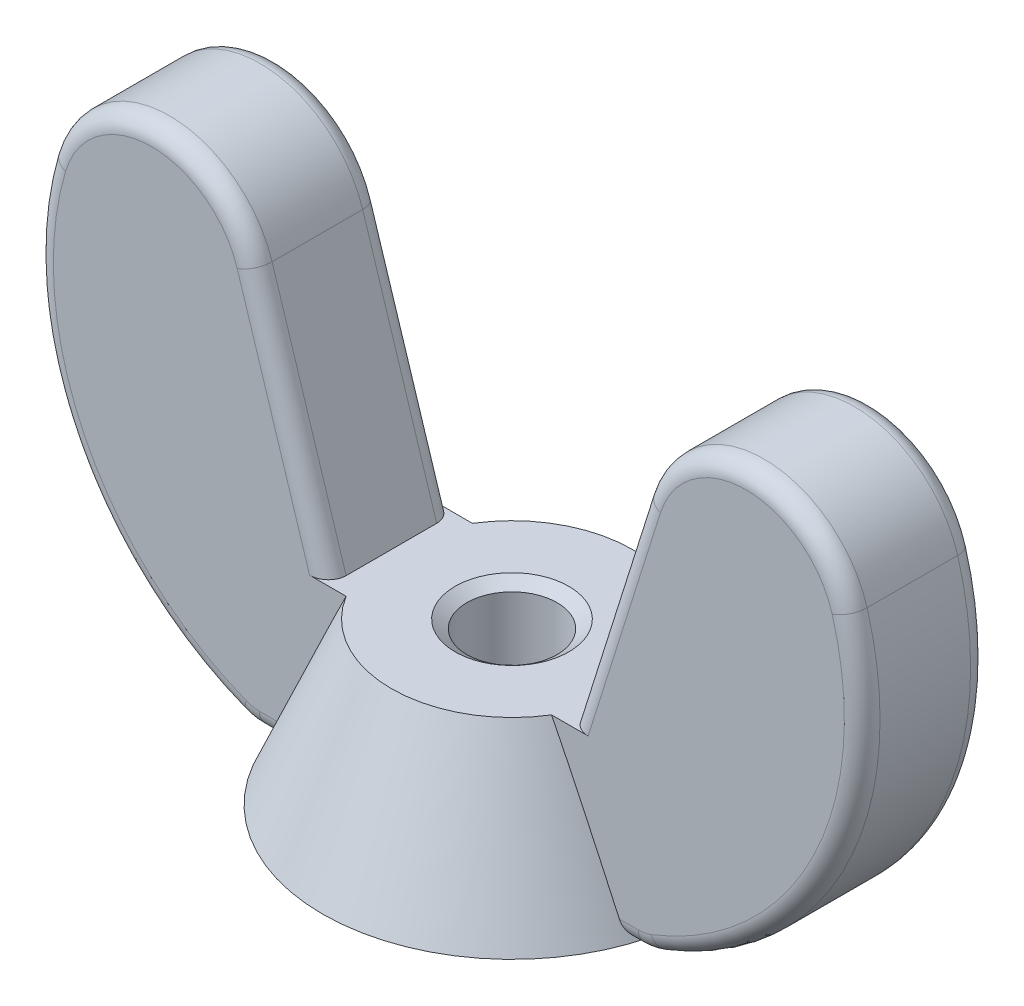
SolidWorks part; units mm, degrees
ref_plane "Front Plane" through (0, 0, 0) normal (0, 0, 1) x (1, 0, 0)
ref_plane "Top Plane" through (0, 0, 0) normal (0, 1, 0) x (1, 0, 0)
ref_plane "Right Plane" through (0, 0, 0) normal (1, 0, 0) x (0, 0, -1)
sketch "WingSke" plane through (0, 0, 0) normal (0, 0, 1) x (1, 0, 0)
  line L0 (-98.8178, 0) -> (98.8178, 0) construction
  line L1 (4.6101, 0) -> (-4.6101, 0) construction
  line L2 (0, 62.7504) -> (0, -62.7504) construction
  line L3 (-2.667, 3.556) -> (2.667, 3.556)
  line L4 (2.667, 3.556) -> (4.3047, 8.7501)
  line L7 (4.191, 0) -> (-4.191, 0)
  line L10 (-4.3047, 8.7501) -> (-2.667, 3.556)
  arc A0 (4.3047, 8.7501) -> (8.8574, 8.7032) centre (6.5739, 8.0346) cw
  arc A1 (8.8574, 8.7032) -> (4.6228, 0.0814) centre (2.032, 6.7048) cw
  arc A2 (4.6228, 0.0814) -> (4.191, 0) centre (4.191, 1.1853) cw
  arc A3 (-4.191, 0) -> (-4.6228, 0.0814) centre (-4.191, 1.1853) cw
  arc A4 (-4.6228, 0.0814) -> (-8.8574, 8.7032) centre (-2.032, 6.7048) cw
  arc A5 (-8.8574, 8.7032) -> (-4.3047, 8.7501) centre (-6.5739, 8.0346) cw
  circle A6 centre (0, 0) radius 4.191 construction
  point P29 (0, 0)
extrude "Wing" add sketch "WingSke" along normal mid plane 2.794
sketch "BossSke" plane through (0, 0, 0) normal (0, 0, 1) x (1, 0, 0)
  line L0 (-2.667, 3.556) -> (-4.191, 0)
  line L1 (2.667, 3.556) -> (-2.667, 3.556) construction
  line L2 (4.6101, 0) -> (-4.6101, 0) construction
  line L3 (-4.191, 0) -> (0, 0)
  line L4 (0, 0) -> (0, 3.556)
  line L5 (0, 3.556) -> (-2.667, 3.556)
revolve "Boss" add sketch "BossSke" angle 360 about L4
sketch "BossHoleSke" plane through (0, 0, 0) normal (0, 0, 1) x (1, 0, 0)
  line L0 (0, 3.556) -> (0, 0)
  line L1 (2.2718, 3.556) -> (-2.2718, 3.556) construction
  line L2 (0, 0) -> (0.9969, 0)
  line L3 (4.6101, 0) -> (-4.6101, 0) construction
  line L5 (0.9969, 0) -> (0.9969, 3.556)
  line L7 (0.9969, 3.556) -> (0, 3.556)
  line L8 (0, 3.556) -> (0, 7.112) construction
revolve "BossHole" cut sketch "BossHoleSke" angle 360 about L8
sketch "Sketch7" plane through (0, 0, 0) normal (0, 0, 1) x (1, 0, 0)
  line L0 (0.997, 3.3737) -> (1.2573, 3.556)
  line L1 (0.997, 0) -> (0.9969, 3.556) construction
  line L2 (2.2718, 3.556) -> (-2.2718, 3.556) construction
  line L5 (0.9969, 3.556) -> (0.997, 3.3737)
  line L6 (0.997, 0.1823) -> (0.997, 0)
  line L7 (0.997, 0) -> (1.2573, 0)
  line L8 (-3.9513, 0) -> (3.9513, 0) construction
  line L9 (1.2573, 0) -> (0.997, 0.1823)
  line L10 (0.9969, 3.556) -> (1.2573, 3.556)
revolve "Cut-Revolve2" cut sketch "Sketch7" angle 360 about L2
fillet "WingFillet" radius 0.3951 20 edges at (4.0712, 0, -1.397) (4.4107, 0.0205, -1.397) (8.4156, 3.5694, -1.397) (6.5984, 10.4139, -1.397) (-4.0712, 0, -1.397) (-4.4107, 0.0205, -1.397) (-8.4156, 3.5694, -1.397) (-6.5984, 10.4139, -1.397) (4.0712, 0, 1.397) (4.4107, 0.0205, 1.397) (8.4156, 3.5694, 1.397) (6.5984, 10.4139, 1.397) (-4.0712, 0, 1.397) (-4.4107, 0.0205, 1.397) (-8.4156, 3.5694, 1.397) (-6.5984, 10.4139, 1.397) (3.4859, 6.1531, -1.397) (-3.4859, 6.1531, -1.397) (3.4859, 6.1531, 1.397) (-3.4859, 6.1531, 1.397)
sketch "ThdSchSke" plane through (0, 0, 0) normal (0, 0, 1) x (1, 0, 0)
  line L0 (0, 0) -> (0, 3.556) construction
  line L1 (2.2718, 3.556) -> (-2.2718, 3.556) construction
  line L2 (-0.4985, 3.7129) -> (-0.4985, 3.3483)
  line L3 (-0.4985, 3.3483) -> (-0.9969, 3.3483)
  line L4 (-0.9969, 3.3483) -> (-1.2573, 3.5306)
  line L5 (-1.2573, 3.5306) -> (-0.997, 3.7129)
  line L6 (-0.997, 3.7129) -> (-0.4985, 3.7129)
  line L7 (0, 3.0023) -> (2.1821, 3.0023) construction
revolve "ThreadSchematic" [suppressed] cut sketch "ThdSchSke" angle 360 about L0
pattern_linear "ThdSchPat" [suppressed]
equation "\"R@WingSke\" = \"BossHeightG@WingSke\" / 3"
equation "\"D2@WingSke\"=\"BossHeightG@WingSke\"*2"
equation "\"D1@WingFillet\"=\"R@WingSke\"/3"
equation "\"Tap_drill@ThdSchSke\" = \"Thread_min@BossHoleSke\""
equation "\"Thread_major@ThdSchSke\" = \"Thread_Major@ThreadCosmetic\""
equation "\"D1@ThdSchSke\" = \"Tap_drill@ThdSchSke\" * 0.5"
equation "\"Advance@ThdSchPat\" =  ( \"BossHeightG@WingSke\" - 0.002 )  /  ( \"Num_Threads@ThdSchPat\" - 1 ) 'relax it"
equation "\"Num_Threads@ThdSchPat\"=int(  (\"BossHeightG@WingSke\" - 0.002 ) / \"Advance@ThdSchSke\" + 0.999 )  + 1"
equation "\"D3@Sketch7\" = \"Thread_Major@ThreadCosmetic\" * 0.5"
